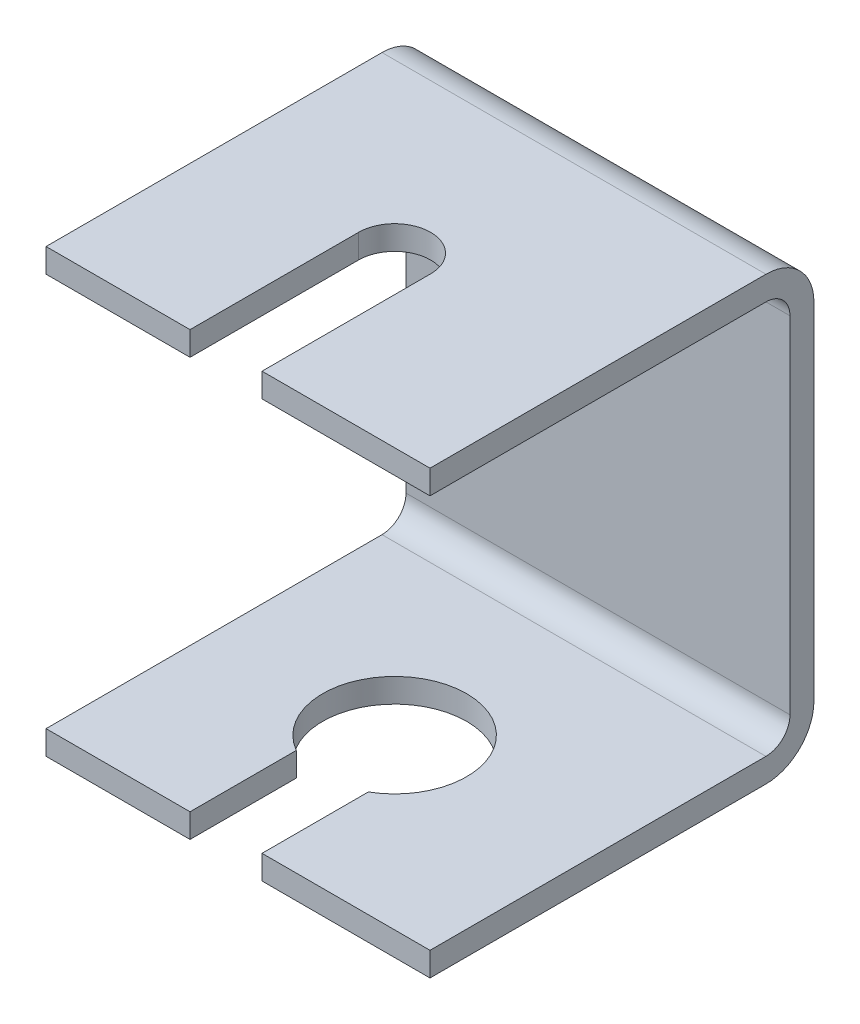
SolidWorks part; units mm, degrees
ref_plane "Front Plane" through (0, 0, 0) normal (0, 0, 1) x (1, 0, 0)
ref_plane "Top Plane" through (0, 0, 0) normal (0, 1, 0) x (1, 0, 0)
ref_plane "Right Plane" through (0, 0, 0) normal (1, 0, 0) x (0, 0, -1)
sketch "Sketch2" plane through (0, 0, 0) normal (1, 0, 0) x (0, 0, -1)
  line L0 (0, 27.6225) -> (0, 29.21)
  line L1 (0, 0) -> (25.4, 0)
  line L2 (0, 0) -> (0, 1.5875)
  line L3 (0, 29.21) -> (25.4, 29.21)
  line L4 (25.4, 0) -> (25.4, 29.21)
  line L5 (0, 27.6225) -> (23.8125, 27.6225)
  line L7 (0, 1.5875) -> (23.8125, 1.5875)
  line L8 (23.8125, 27.6225) -> (23.8125, 1.5875)
  dimension "D1" = 29.21
  dimension "D2" = 25.4
  dimension "D3" = 1.5875
  dimension "D4" = 1.5875
  dimension "D5" = 1.5875
extrude "Boss-Extrude1" add sketch "Sketch2" along normal blind 25.4
fillet "Fillet1" radius 1.5875 2 edges at (12.7, 27.6225, -23.8125) (12.7, 1.5875, -23.8125)
fillet "Fillet2" radius 3.175 2 edges at (12.7, 29.21, -25.4) (12.7, 0, -25.4)
sketch "Sketch3" plane through (0, 29.21, 0) normal (0, 1, 0) x (1, 0, 0)
  line L2 (9.525, 11.1542) -> (9.525, -0.6567)
  line L3 (9.525, -0.6567) -> (14.2875, -0.6567)
  line L4 (14.2875, 11.1542) -> (14.2875, -0.6567)
  arc A0 (14.2875, 11.1542) -> (9.525, 11.1542) centre (11.9063, 11.1542) ccw
  dimension "D1" = 4.7625
extrude "Cut-Extrude1" cut sketch "Sketch3" against normal through all
sketch "Sketch4" plane through (0, 0, 0) normal (0, -1, 0) x (1, 0, 0)
  circle A0 centre (11.9063, -11.1542) radius 4.7625
  dimension "D1" = 9.525
extrude "Cut-Extrude2" cut sketch "Sketch4" against normal blind 25.4
